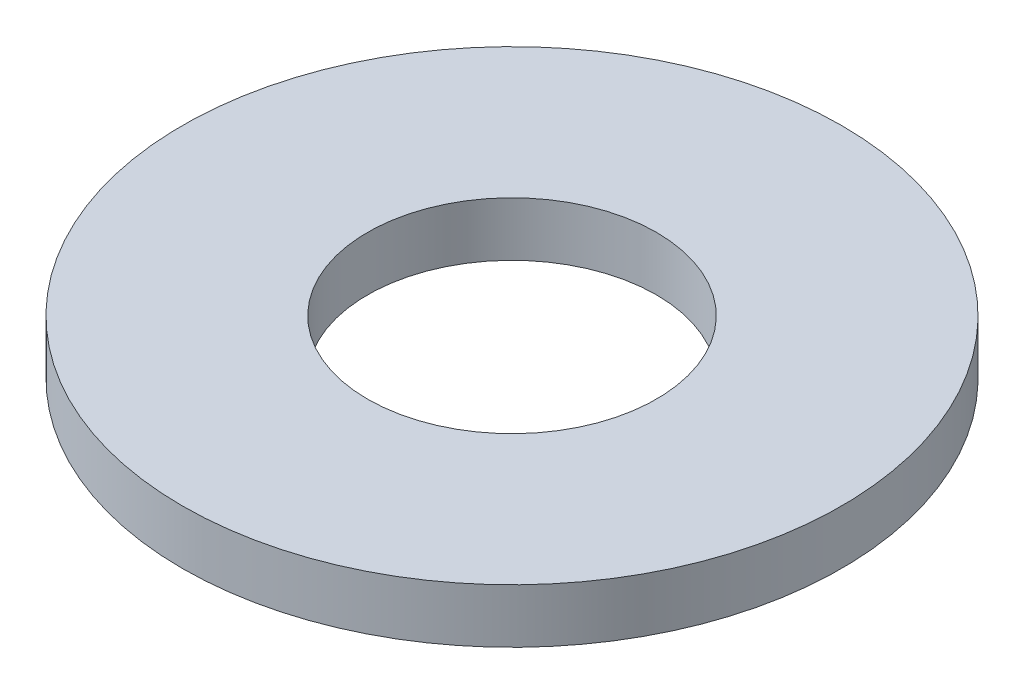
SolidWorks part; units mm, degrees
ref_plane "Front Plane" through (0, 0, 0) normal (0, 0, 1) x (1, 0, 0)
ref_plane "Top Plane" through (0, 0, 0) normal (0, 1, 0) x (1, 0, 0)
ref_plane "Right Plane" through (0, 0, 0) normal (1, 0, 0) x (0, 0, -1)
sketch "Sketch1" plane through (0, 0, 0) normal (0, 1, 0) x (1, 0, 0)
  circle A0 centre (0, 0) radius 1.6
  circle A1 centre (0, 0) radius 3.65
  dimension "D1" = 3.2
  dimension "D2" = 7.3
extrude "Boss-Extrude1" add sketch "Sketch1" along normal blind 0.6
